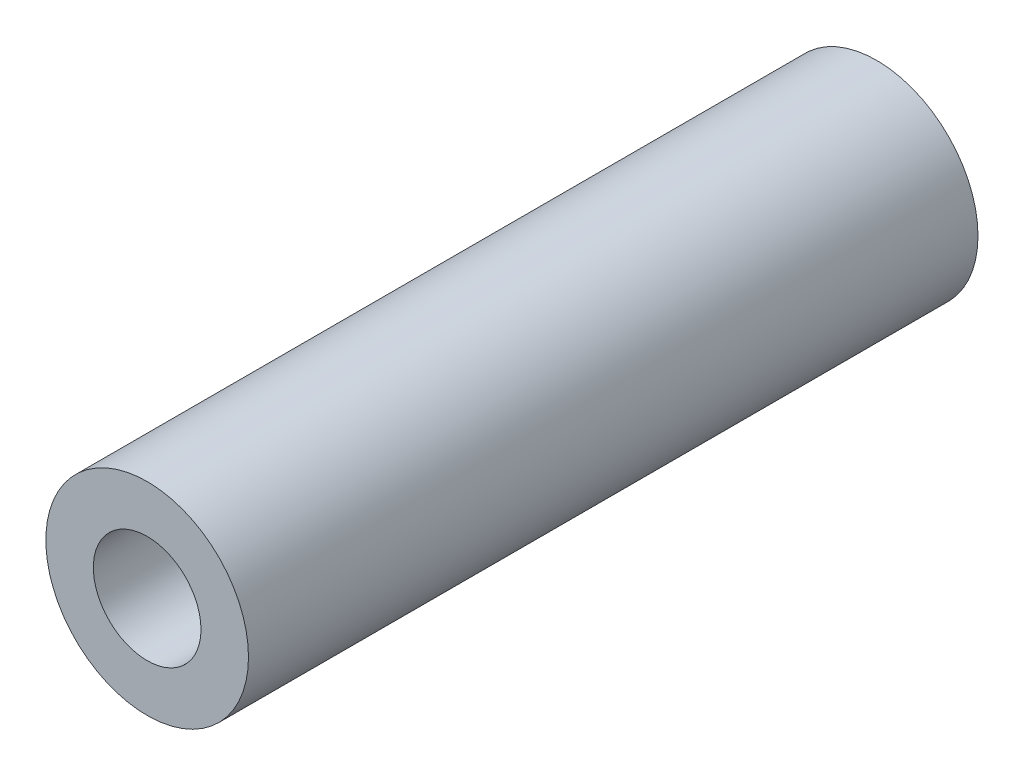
SolidWorks part; units mm, degrees
ref_plane "Front Plane" through (0, 0, 0) normal (0, 0, 1) x (1, 0, 0)
ref_plane "Top Plane" through (0, 0, 0) normal (0, 1, 0) x (1, 0, 0)
ref_plane "Right Plane" through (0, 0, 0) normal (1, 0, 0) x (0, 0, -1)
sketch "Sketch1" plane through (0, 0, 0) normal (0, 0, 1) x (1, 0, 0)
  circle A0 centre (0, 0) radius 3.9688
  circle A1 centre (0, 0) radius 2.1082
  dimension "OD" = 7.9375
  dimension "ID" = 4.2164
extrude "Extrude1" add sketch "Sketch1" along normal mid plane 28.575
sketch "Sketch2" plane through (0, 0, 0) normal (1, 0, 0) x (0, 0, -1)
  line L0 (-14.2875, -2.1082) -> (14.2875, -2.1082) construction
  line L3 (14.2875, 2.1082) -> (-14.2875, 2.1082) construction
  line L5 (-14.2875, -2.1082) -> (14.2875, -2.1082)
  line L6 (14.2875, 2.1082) -> (-14.2875, 2.1082)
sketch "Sketch4" plane through (0, 0, 14.2875) normal (0, 0, 1) x (1, 0, 0)
  line L0 (0, 0) -> (-1.4907, 1.4907)
  line L1 (0, -2.1828) -> (0, 2.1828) construction
  circle A0 centre (0, 0) radius 2.1082 construction
  dimension "D1" = 45
